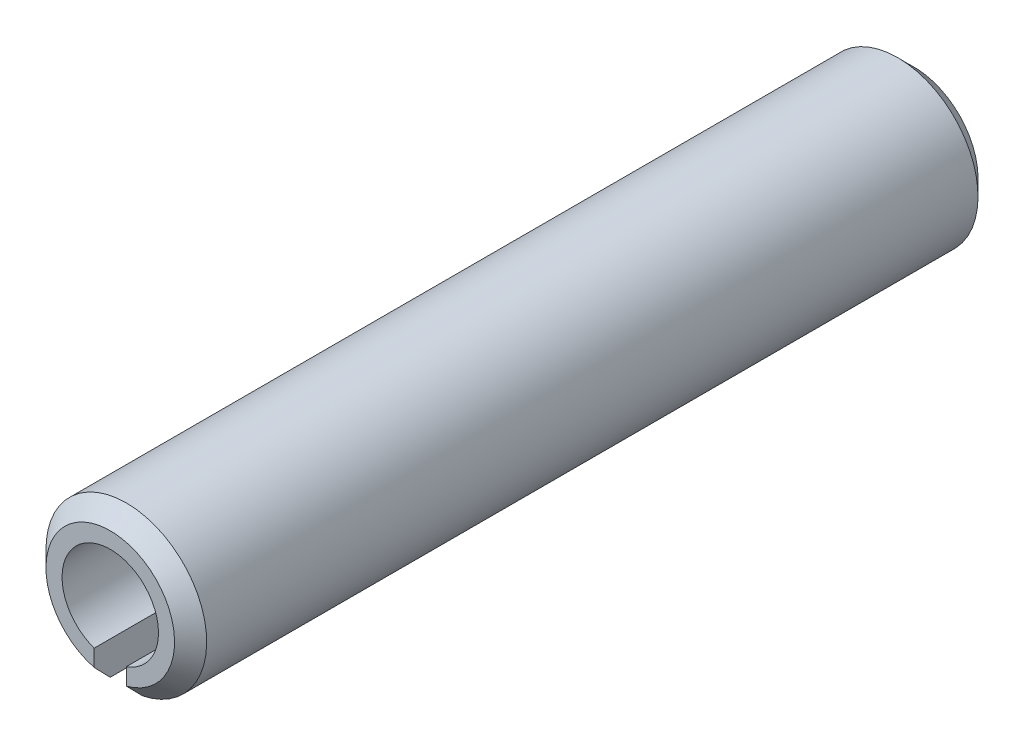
SolidWorks part; units mm, degrees
ref_plane "Plan de face" through (0, 0, 0) normal (0, 0, 1) x (1, 0, 0)
ref_plane "Plan de dessus" through (0, 0, 0) normal (0, 1, 0) x (1, 0, 0)
ref_plane "Plan de droite" through (0, 0, 0) normal (1, 0, 0) x (0, 0, -1)
sketch "Esquisse1" plane through (0, 0, 0) normal (0, 0, 1) x (1, 0, 0)
  line L0 (-1, -2.8284) -> (-1, -4.899)
  line L1 (1, -2.8284) -> (1, -4.899)
  line L2 (0, 7.6881) -> (0, -6.5252) construction
  arc A0 (1, -4.899) -> (-1, -4.899) centre (0, 0) ccw
  arc A1 (1, -2.8284) -> (-1, -2.8284) centre (0, 0) ccw
  dimension "D1" = 10
  dimension "D2" = 6
  dimension "D3" = 1
  dimension "D4" = 1
extrude "Extrusion1" add sketch "Esquisse1" against normal blind 50
chamfer "Chanfrein1" distance 1 angle 45 2 edges at (0, 5, -50) (0, 5, 0)
